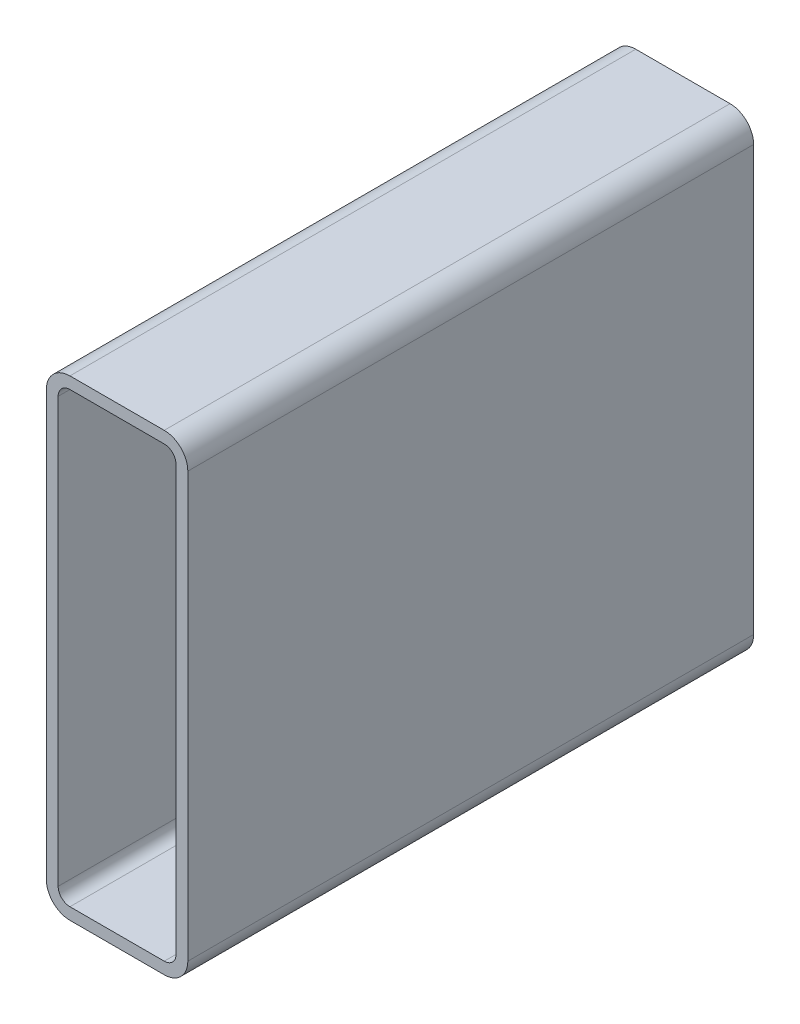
SolidWorks part; units mm, degrees
ref_plane "Front Plane" through (0, 0, 0) normal (0, 0, 1) x (1, 0, 0)
ref_plane "Top Plane" through (0, 0, 0) normal (0, 1, 0) x (1, 0, 0)
ref_plane "Right Plane" through (0, 0, 0) normal (1, 0, 0) x (0, 0, -1)
sketch "Sketch1" plane through (0, 0, 0) normal (0, 0, 1) x (1, 0, 0)
sketch_block_instance "HSS10x3x0.250-1"
sketch_block "HSS10x3x0.250"
extrude "Boss-Extrude1" add sketch "Sketch1" along normal blind 304.8
